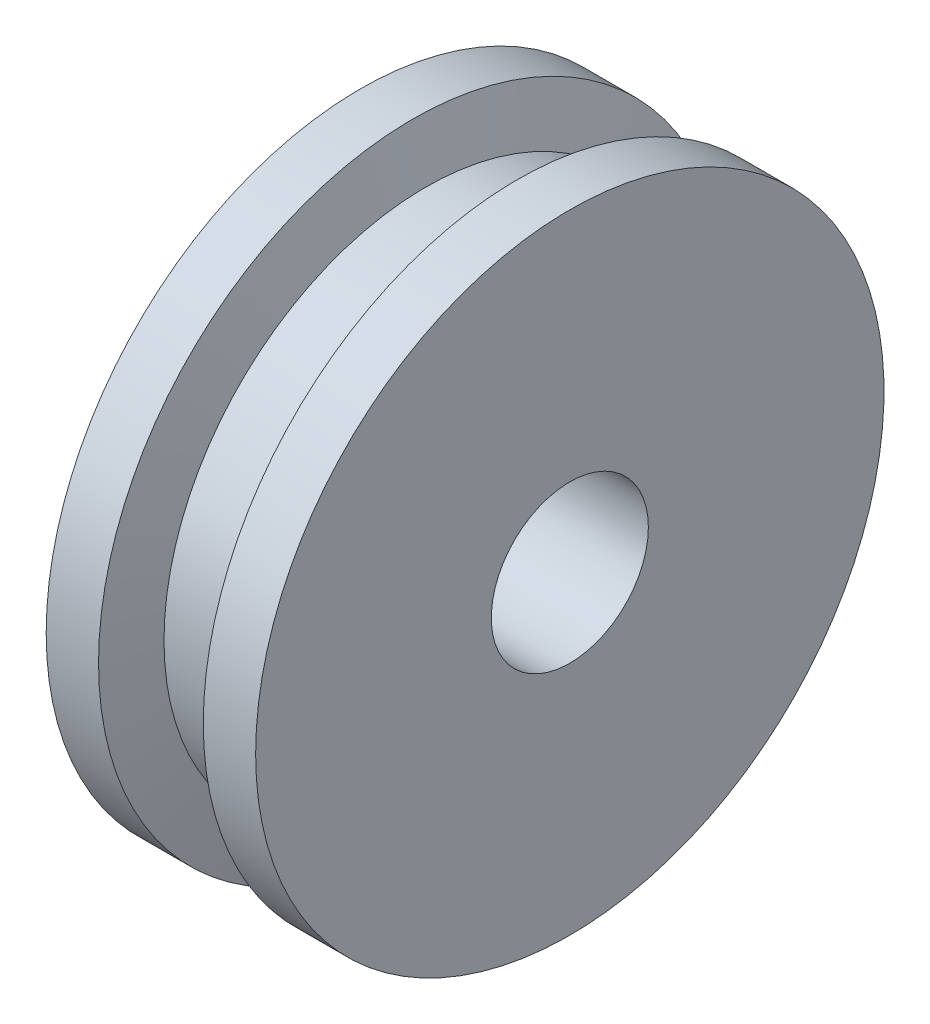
SolidWorks part; units mm, degrees
ref_plane "Plan de face" through (0, 0, 0) normal (0, 0, 1) x (1, 0, 0)
ref_plane "Plan de dessus" through (0, 0, 0) normal (0, 1, 0) x (1, 0, 0)
ref_plane "Plan de droite" through (0, 0, 0) normal (1, 0, 0) x (0, 0, -1)
sketch "Esquisse1" plane through (0, 0, 0) normal (0, 0, 1) x (1, 0, 0)
  line L0 (-12.9633, 0) -> (9.3269, 0) construction
  line L1 (-2, 12) -> (-1.5, 10)
  line L2 (-4, 0) -> (4, 0)
  line L3 (-4, 0) -> (-4, 12)
  line L4 (-4, 12) -> (-2, 12)
  line L5 (4, 0) -> (4, 12)
  line L6 (-1.5, 10) -> (1.5, 10)
  line L7 (1.5, 10) -> (2, 12)
  line L8 (2, 12) -> (4, 12)
  point P15 (0, 10)
  point P18 (0, 0)
  dimension "D1" = 12
  dimension "D2" = 8
  dimension "D3" = 3
  dimension "D4" = 2
  dimension "D5" = 2
  dimension "D6" = 2
revolve "Révolution1" add sketch "Esquisse1" angle 360 about L0
sketch "Esquisse2" plane through (-4, 0, 0) normal (-1, 0, 0) x (0, 0, 1)
  circle A0 centre (0, 0) radius 9.6
  dimension "D1" = 19.2
sketch "Esquisse3" plane through (4, 0, 0) normal (1, 0, 0) x (0, 0, -1)
  circle A0 centre (0, 0) radius 3
  dimension "D1" = 6
extrude "Enlèv. mat.-Extru.2" cut sketch "Esquisse3" against normal blind 8
